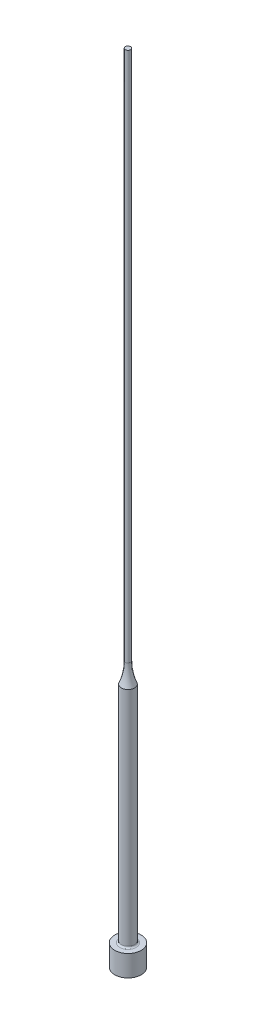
SolidWorks part; units mm, degrees
ref_plane "Front Plane" through (0, 0, 0) normal (0, 0, 1) x (1, 0, 0)
ref_plane "Top Plane" through (0, 0, 0) normal (0, 1, 0) x (1, 0, 0)
ref_plane "Right Plane" through (0, 0, 0) normal (1, 0, 0) x (0, 0, -1)
sketch "Sketch1" plane through (0, 0, 0) normal (0, 0, 1) x (1, 0, 0)
  line L0 (0, 0) -> (2.5, 0)
  line L1 (55, 0) -> (-55, 0) construction
  line L2 (2.5, 0) -> (2.5, 4)
  line L3 (2.5, 4) -> (1.55, 4)
  line L4 (1.25, 4.3) -> (1.25, 46.2003)
  line L6 (0.5, 50) -> (0.5, 150)
  line L7 (0.5, 150) -> (0, 150)
  line L8 (0, 150) -> (0, 0)
  arc A0 (0.5, 50) -> (1.25, 46.2003) centre (10.5, 50) ccw
  arc A1 (1.55, 4) -> (1.25, 4.3) centre (1.55, 4.3) cw
  dimension "D7" = 50
  dimension "D8" = 0.3
  dimension "D5" = 10
  dimension "D1" = 0.5
  dimension "D2" = 1.25
  dimension "D3" = 2.5
  dimension "D4" = 4
  dimension "D6" = 150
revolve "Revolve1" add sketch "Sketch1" angle 360 about L8
